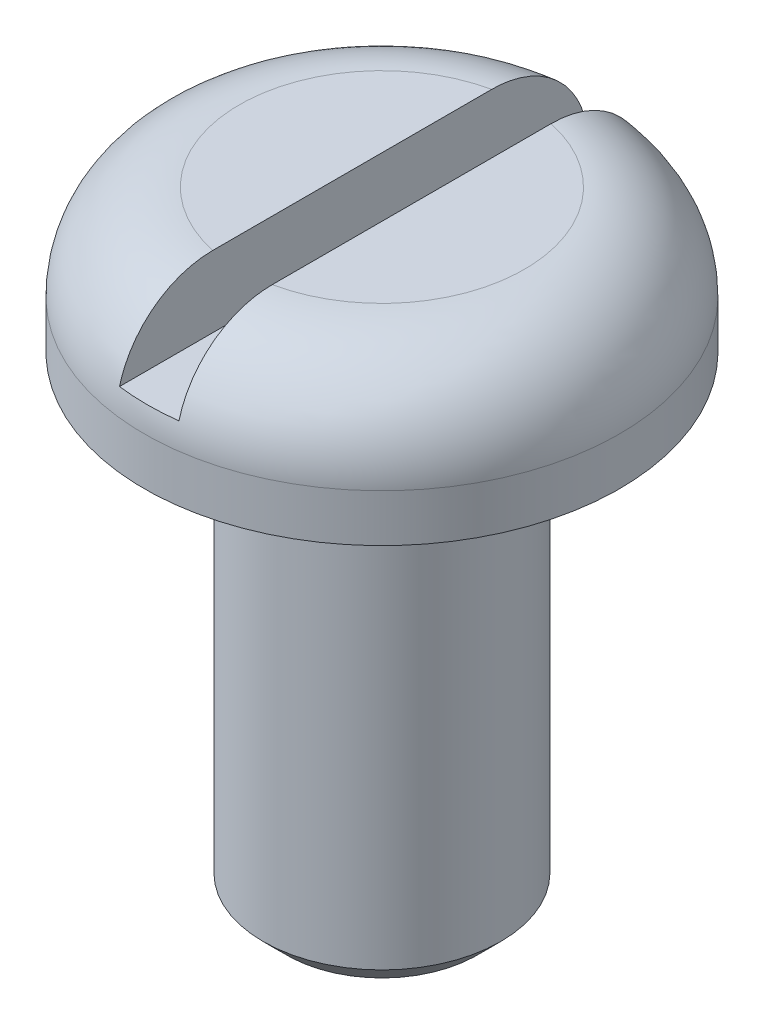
SolidWorks part; units mm, degrees
ref_plane "Front" through (0, 0, 0) normal (0, 0, 1) x (1, 0, 0)
ref_plane "Top" through (0, 0, 0) normal (0, 1, 0) x (1, 0, 0)
ref_plane "Right" through (0, 0, 0) normal (1, 0, 0) x (0, 0, -1)
sketch "Sketch1" plane through (0, 0, 0) normal (0, 0, 1) x (1, 0, 0)
  line L0 (0, 0) -> (0, 50.2418) construction
  line L1 (0, 0) -> (0, 1.2)
  line L2 (0, 0) -> (2, 0)
  line L4 (0, 1.2) -> (1.2, 1.2)
  line L5 (2, 0) -> (2, 0.4)
  arc A0 (1.2, 1.2) -> (2, 0.4) centre (1.2, 0.4) cw
  dimension "D1" = 0.8
  dimension "D2" = 1.2
  dimension "D3" = 4
revolve "Revolve1" add sketch "Sketch1" angle 360 about L0
sketch "Sketch2" plane through (0, 1.2, 0) normal (0, 1, 0) x (1, 0, 0)
  line L0 (0, -2.266) -> (0, 2.3065) construction
  line L1 (-0.25, 2.927) -> (0.25, 2.927)
  line L2 (-0.25, 2.927) -> (-0.25, -2.8865)
  line L3 (-0.25, -2.8865) -> (0.25, -2.8865)
  line L4 (0.25, 2.927) -> (0.25, -2.8865)
  dimension "D1" = 0.5
extrude "Cut-Extrude1" cut sketch "Sketch2" against normal blind 0.6
sketch "Sketch3" plane through (0, 0, 0) normal (0, -1, 0) x (1, 0, 0)
  circle A0 centre (0, 0) radius 1
  dimension "D1" = 2
extrude "Boss-Extrude1" add sketch "Sketch3" along normal blind 4
sketch "Sketch4" plane through (0, -4, 0) normal (0, -1, 0) x (1, 0, 0)
  circle A0 centre (0, 0) radius 0.8
  dimension "D1" = 1.6
extrude "Cut-Extrude2" cut sketch "Sketch4" against normal blind 4 draft 45 flip side to cut
